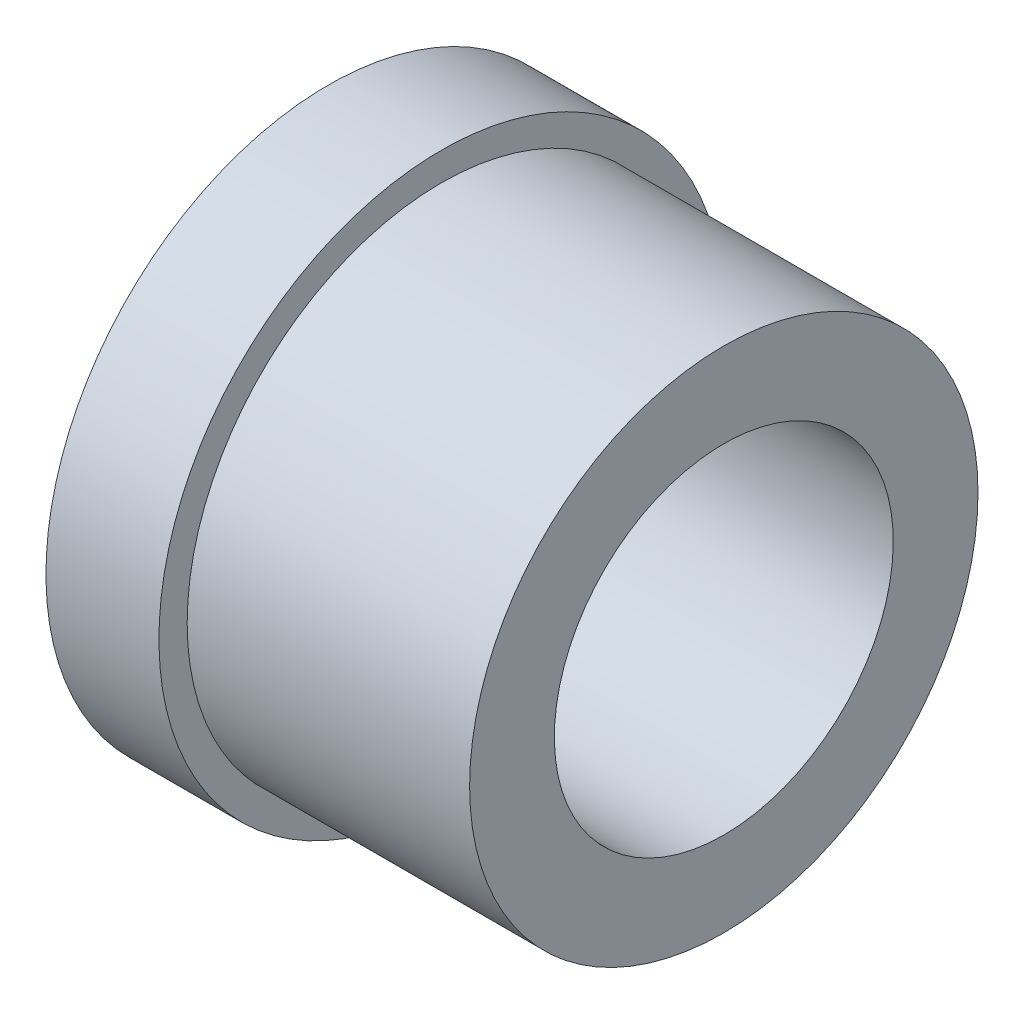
SolidWorks part; units mm, degrees
ref_plane "Face" through (0, 0, 0) normal (0, 0, 1) x (1, 0, 0)
ref_plane "Dessus" through (0, 0, 0) normal (0, 1, 0) x (1, 0, 0)
ref_plane "Droite" through (0, 0, 0) normal (1, 0, 0) x (0, 0, -1)
sketch "Esquisse1" plane through (0, 0, 0) normal (0, 0, 1) x (1, 0, 0)
  line L0 (-70, 5) -> (-70, 3)
  line L1 (-70, 3) -> (-63, 3)
  line L2 (-63, 3) -> (-63, 4.5)
  line L3 (-63, 4.5) -> (-68, 4.5)
  line L4 (-68, 4.5) -> (-68, 5)
  line L5 (-68, 5) -> (-70, 5)
  line L6 (-63, 9.2) -> (-63, -9.2) construction
  line L7 (-57, 3) -> (-83.5, 3) construction
  line L8 (-88.6886, 0) -> (-43.1967, 0) construction
  line L9 (-63, 0) -> (-95.5, 0) construction
  line L10 (-84, 0) -> (34.5, 0) construction
  dimension "D1" = 1.5
  dimension "D2" = 7
  dimension "D3" = 2
  dimension "D4" = 10
revolve "Révolution1" add sketch "Esquisse1" angle 360 about L8
